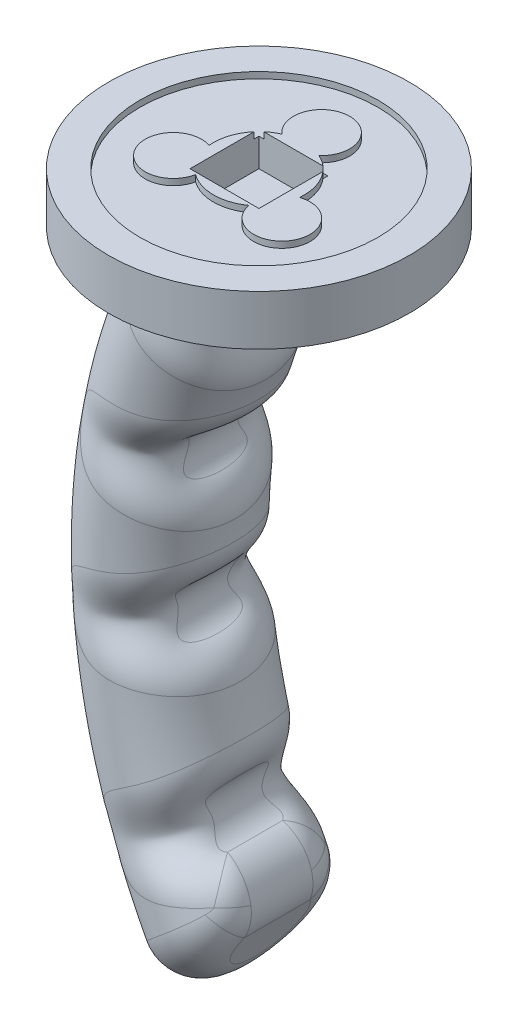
SolidWorks part; units mm, degrees
ref_plane "Front Plane" through (0, 0, 0) normal (0, 0, 1) x (1, 0, 0)
ref_plane "Top Plane" through (0, 0, 0) normal (0, 1, 0) x (1, 0, 0)
ref_plane "Right Plane" through (0, 0, 0) normal (1, 0, 0) x (0, 0, -1)
sketch "Sketch1" plane through (0, 0, 0) normal (0, 1, 0) x (1, 0, 0)
  circle A0 centre (0, 0) radius 24
  dimension "D1" = 48
extrude "Boss-Extrude1" add sketch "Sketch1" along normal blind 8
sketch "Sketch2" plane through (0, 8, 0) normal (0, 1, 0) x (1, 0, 0)
  circle A0 centre (0, 0) radius 19
  arc A1 (-2.9658, 6.6156) -> (-7.2122, -0.7393) centre (0, 0) ccw
  arc A2 (2.9658, 6.6156) -> (-2.9658, 6.6156) centre (0, 10) ccw
  arc A3 (4.2464, -5.8763) -> (7.2122, -0.7393) centre (8.6603, -5) ccw
  arc A4 (-7.2122, -0.7393) -> (-4.2464, -5.8763) centre (-8.6603, -5) ccw
  arc A5 (-4.2464, -5.8763) -> (4.2464, -5.8763) centre (0, 0) ccw
  arc A6 (7.2122, -0.7393) -> (2.9658, 6.6156) centre (0, 0) ccw
  point P13 (0, 0)
  dimension "D1" = 38
  dimension "D2" = 14.5
  dimension "D3" = 9
  dimension "D4" = 10
  dimension "D5" = 3
extrude "Cut-Extrude1" cut sketch "Sketch2" against normal blind 1
sketch "Sketch3" plane through (0, 8, 0) normal (0, 1, 0) x (1, 0, 0)
  line L0 (-5.5, 5.5) -> (5.5, 5.5)
  line L1 (5.5, 5.5) -> (5.5, -5.5)
  line L2 (5.5, -5.5) -> (-5.5, -5.5)
  line L3 (-5.5, -5.5) -> (-5.5, 5.5)
  dimension "D1" = 11
  dimension "D2" = 5.5
  dimension "D3" = 11
  dimension "D4" = 5.5
extrude "Cut-Extrude2" cut sketch "Sketch3" against normal blind 5.5
ref_plane "Plane1" through (0, -30, 0) normal (0, -1, 0) x (-1, 0, 0)
ref_plane "Plane2" through (0, -100, 0) normal (0, -1, 0) x (-1, 0, 0)
sketch "Sketch5" plane through (0, 0, 0) normal (0, -1, 0) x (1, 0, 0)
  circle A0 centre (0, 0) radius 12
  dimension "D1" = 24
sketch "Sketch6" plane through (0, -30, 0) normal (0, -1, 0) x (-1, 0, 0)
  circle A0 centre (12, 0) radius 12
  dimension "D1" = 24
  dimension "D2" = 12
sketch "Sketch7" plane through (0, -100, 0) normal (0, -1, 0) x (-1, 0, 0)
  circle A0 centre (0, 0) radius 12
sketch "Sketch8" plane through (0, 0, 0) normal (0, 0, 1) x (1, 0, 0)
  line L2 (-24, 0) -> (24, 0) construction
  line L3 (-12, -100) -> (12, -100) construction
  arc A0 (0, 0) -> (0, -100) centre (81.575, -50) ccw
sweep "Sweep1" add profiles "Sketch5" path "Sketch8"
fillet "Fillet4" radius 6 1 edges at (0, -100, -12)
sketch "Sketch16" [suppressed] plane through (0, 0, 0) normal (0, 0, 1) x (1, 0, 0)
  line L0 (-0.6307, -101.2383) -> (4.0791, -91.9905)
  line L1 (-12, 0) -> (12, 0)
  arc A0 (-11.2253, -101.4235) -> (-0.6307, -101.2383) centre (-5.9772, -98.5154) ccw
sketch "Sketch17" plane through (0, 0, 0) normal (0, 0, 1) x (1, 0, 0)
  line L0 (4.7852, -7.4094) -> (4.7852, -21.8377)
  line L1 (-5.4458, -110.6931) -> (5.4458, -89.3069) construction
  line L2 (-11.2253, -101.4235) -> (4.1543, -86.6976)
  line L3 (-12, 0) -> (12, 0)
  line L4 (-68.9761, -80) -> (77.5035, -80)
  line L5 (-2.3993, -28.4508) -> (-2.3993, -40.1729)
  line L6 (90.4641, -100) -> (-70.9324, -100)
  line L7 (65.2765, -55) -> (-77.7796, -55)
  line L8 (1.3211, -69.7141) -> (1.3211, -91.427)
  line L9 (63.5647, -33) -> (-83.8931, -33)
  line L10 (-3.9568, -66.0159) -> (-3.9568, -41.9035)
  line L11 (70.1673, -12) -> (-77.7796, -12)
  arc A2 (0, 0) -> (0, -100) centre (81.575, -50) ccw
  arc A3 (12, 0) -> (4.1543, -86.6976) centre (81.575, -50) ccw construction
  arc A4 (4.1543, -86.6976) -> (12, 0) centre (81.575, -50) cw
  arc A5 (-12, 0) -> (-11.2253, -101.4235) centre (81.575, -50) ccw
  arc A6 (-12, 0) -> (-11.2253, -101.4235) centre (81.575, -50) ccw construction
  point P4 (4.7852, -12)
  point P35 (-2.3993, -33)
  point P38 (-3.9568, -55)
  point P39 (1.3211, -80)
  dimension "D1" = 0
  dimension "D2" = 0
  dimension "D3" = 0
  dimension "D4" = 12
  dimension "D5" = 33
  dimension "D6" = 55
  dimension "D7" = 80
ref_plane "Plane3" through (1.3211, 0, 0) normal (1, 0, 0) x (0, 0, -1)
ref_plane "Plane4" through (-3.9568, 0, 0) normal (1, 0, 0) x (0, 0, -1)
ref_plane "Plane5" through (-2.3993, 0, 0) normal (1, 0, 0) x (0, 0, -1)
ref_plane "Plane6" through (4.7852, 0, 0) normal (1, 0, 0) x (0, 0, -1)
sketch "Sketch18" plane through (1.3211, 0, 0) normal (1, 0, 0) x (0, 0, -1)
  line L0 (-12, -80) -> (12, -80)
  line L1 (-12, 0) -> (-12, -93.7162) construction
  line L2 (12, -93.7162) -> (12, 0) construction
  line L3 (12, -80) -> (12, -85)
  line L4 (12, -93.7162) -> (12, 0) construction
  line L5 (12, -85) -> (-12, -85)
  line L6 (-12, 0) -> (-12, -93.7162) construction
  line L7 (-12, -85) -> (-12, -80)
  dimension "D1" = 5
  dimension "D2" = 0
revolve "Cut-Revolve3" cut sketch "Sketch18" angle 360 about L0
sketch "Sketch19" plane through (-3.9568, 0, 0) normal (1, 0, 0) x (0, 0, -1)
  line L1 (-12, -55) -> (11.9282, -55)
  line L2 (-12, 0) -> (-12, -93.7162) construction
  line L3 (11.9282, -55) -> (11.9282, -60)
  line L4 (11.9282, -60) -> (-12, -60)
  line L5 (-12, -60) -> (-12, -55)
  dimension "D1" = 5
revolve "Cut-Revolve4" cut sketch "Sketch19" angle 360 about L1
sketch "Sketch20" plane through (-2.3993, 0, 0) normal (1, 0, 0) x (0, 0, -1)
  line L0 (-12, -33) -> (12, -33)
  line L1 (12, -93.7162) -> (12, 0) construction
  line L3 (12, -33) -> (12, -38)
  line L5 (-12, 0) -> (-12, -93.7162) construction
  line L7 (12, -38) -> (-12, -38)
  line L8 (-12, -38) -> (-12, -33)
  dimension "D1" = 5
revolve "Cut-Revolve5" cut sketch "Sketch20" angle 360 about L0
sketch "Sketch21" plane through (4.7852, 0, 0) normal (1, 0, 0) x (0, 0, -1)
  line L4 (-12, -12) -> (12, -12)
  line L5 (12, -12) -> (12, -17)
  line L6 (12, -17) -> (-12, -17)
  line L7 (-12, -17) -> (-12, -12)
  dimension "D1" = 24
  dimension "D3" = 5
revolve "Cut-Revolve6" cut sketch "Sketch21" angle 360 about L4
fillet "Fillet7" radius 7 4 edges at (1.3185, -8.3969, 10.2361) (-6.2354, -29.7931, 10.012) (-7.1375, -51.1422, 8.6796) (-3.5303, -78.7902, 9.7962)
